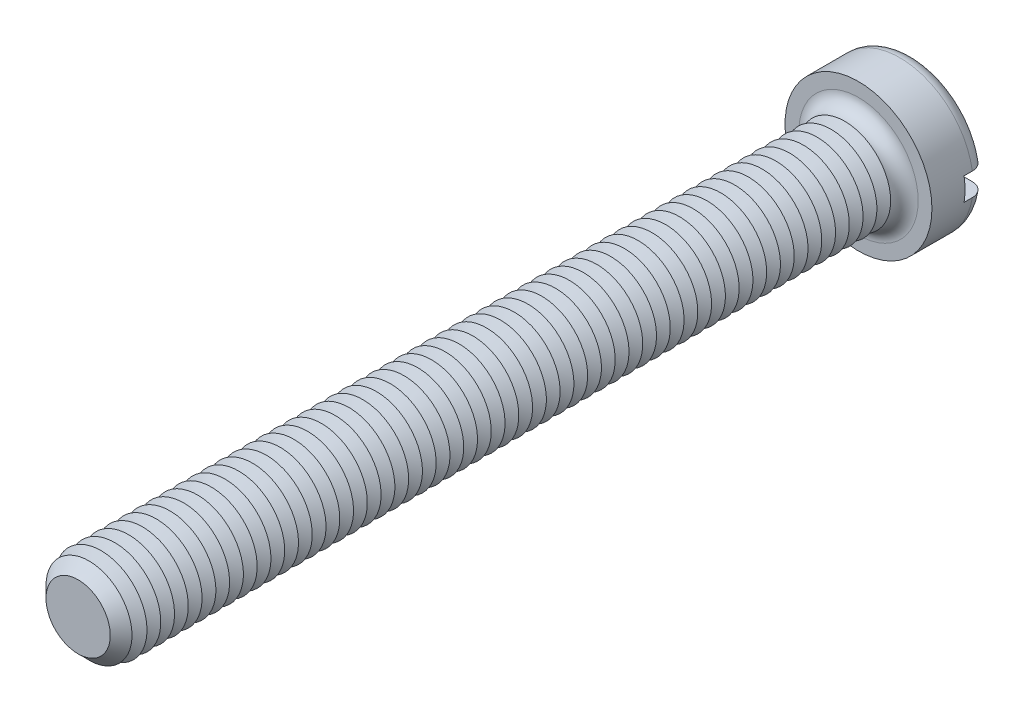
SolidWorks part; units mm, degrees
ref_plane "Front Plane" through (0, 0, 0) normal (0, 0, 1) x (1, 0, 0)
ref_plane "Top Plane" through (0, 0, 0) normal (0, 1, 0) x (1, 0, 0)
ref_plane "Right Plane" through (0, 0, 0) normal (1, 0, 0) x (0, 0, -1)
sketch "Sketch3" plane through (0, 0, 0) normal (0, 0, 1) x (1, 0, 0)
  circle A0 centre (0, 0) radius 8
  dimension "D1" = 16
extrude "Boss-Extrude2" add sketch "Sketch3" against normal blind 6
sketch "Sketch4" plane through (0, 0, 0) normal (0, 0, 1) x (1, 0, 0)
  circle A0 centre (0, 0) radius 5
  dimension "D1" = 10
extrude "Boss-Extrude3" add sketch "Sketch4" along normal blind 85
fillet "Fillet1" radius 1.5 2 edges at (8, 0, -6) (5, 0, 0)
chamfer "Chamfer1" distance 1.5 angle 45 1 edges at (5, 0, 85)
sketch "Sketch5" plane through (0, 0, 0) normal (1, 0, 0) x (0, 0, -1)
  line L0 (1.6944, 0) -> (-7.6738, 0) construction
sketch "Sketch6" plane through (0, 0, 0) normal (1, 0, 0) x (0, 0, -1)
  line L0 (-1.5, 5) -> (-2.25, 3.701)
  line L1 (-2.25, 3.701) -> (-3, 5)
  line L2 (-1.5, 5) -> (-83.5, 5) construction
  line L3 (-3, 5) -> (-1.5, 5)
  dimension "D1" = 1.5
revolve "Cut-Revolve1" cut sketch "Sketch6" angle 360 about L0
pattern_linear "LPattern1" count 55 spacing 1.5 along (0, 0, 1) of "Cut-Revolve1"
sketch "Sketch8" plane through (0, 0, -6) normal (0, 0, -1) x (-1, 0, 0)
  line L1 (8, -1.25) -> (-8, -1.25)
  line L2 (8, -1.25) -> (8, 1.25)
  line L3 (8, 1.25) -> (-8, 1.25)
  line L4 (-8, -1.25) -> (-8, 1.25)
  line L5 (8, -1.25) -> (-8, 1.25) construction
  line L6 (8, 1.25) -> (-8, -1.25) construction
  point P0 (0, 0)
  dimension "D1" = 16
  dimension "D2" = 2.5
extrude "Cut-Extrude1" cut sketch "Sketch8" against normal blind 2.4
